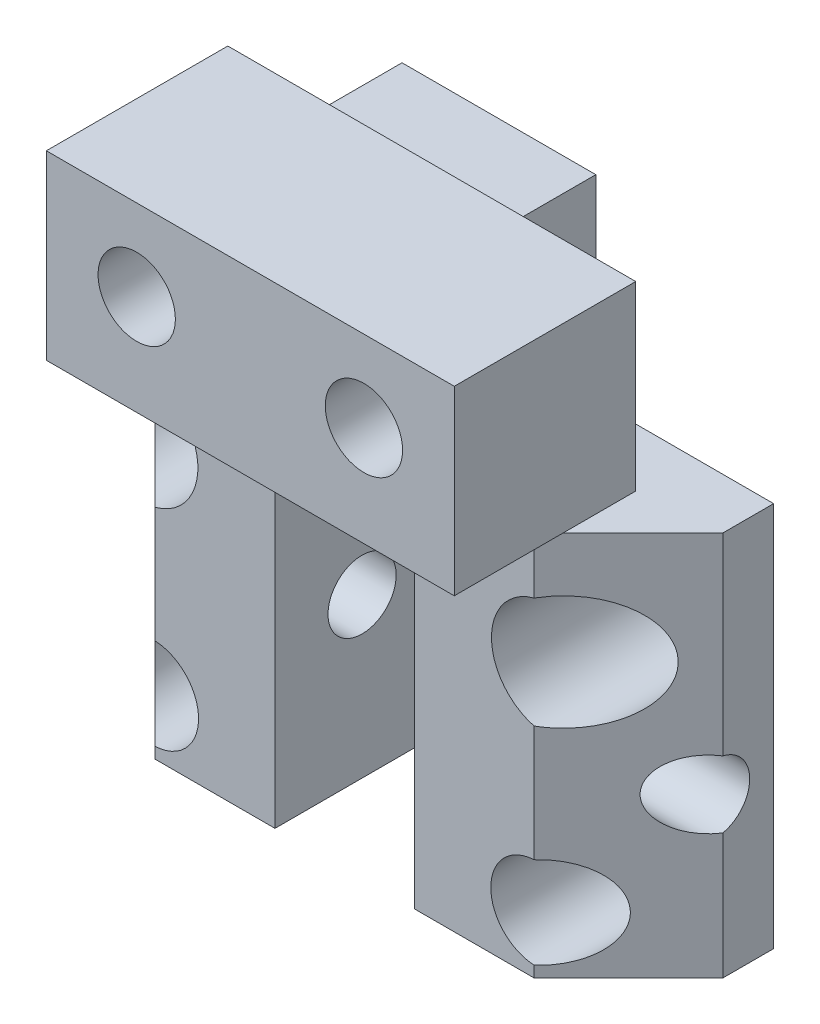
SolidWorks part; units mm, degrees
ref_plane "Front/Back" through (0, 0, 0) normal (0, 0, 1) x (1, 0, 0)
ref_plane "Top/Bottom" through (0, 0, 0) normal (0, 1, 0) x (1, 0, 0)
ref_plane "Right/Left" through (0, 0, 0) normal (1, 0, 0) x (0, 0, -1)
sketch "Sketch1" plane through (0, 0, 0) normal (0, 1, 0) x (1, 0, 0)
  line L0 (-6.7818, 6.858) -> (0, 6.858)
  line L1 (0, 6.858) -> (0, 0)
  line L2 (0, 0) -> (13.081, 0)
  line L3 (13.081, 0) -> (13.081, -5.08)
  line L4 (13.081, -5.08) -> (-6.7818, -5.08)
  line L5 (-6.7818, -5.08) -> (-6.7818, 6.858)
  line L6 (0, 0) -> (0, 54.2418) construction
  line L7 (0, 0) -> (69.3583, 0) construction
  dimension "D1" = 6.7818
  dimension "D2" = 5.08
  dimension "D3" = 11.938
  dimension "D4" = 19.8628
extrude "Extrude1" add sketch "Sketch1" along normal mid plane 13.4874
sketch "Sketch2" plane through (0, 6.7437, 0) normal (0, 1, 0) x (-1, 0, 0)
  line L0 (0, 0) -> (0, 6.5645) construction
  line L1 (0, 0) -> (7.3035, 0) construction
  line L2 (-3.1496, 5.08) -> (-3.1496, 17.5434) construction
  line L3 (-10.287, 2.032) -> (3.9878, 2.032)
  line L4 (-10.287, 2.032) -> (-10.287, 8.382)
  line L5 (-10.287, 8.382) -> (3.9878, 8.382)
  line L6 (3.9878, 2.032) -> (3.9878, 8.382)
  line L7 (6.7818, 5.08) -> (-13.081, 5.08) construction
  line L8 (-3.1496, 8.382) -> (-3.1496, 5.8947) construction
  dimension "D1" = 6.35
  dimension "D2" = 14.2748
  dimension "D3" = 3.302
extrude "Extrude2" add sketch "Sketch2" along normal blind 6.35
sketch "Sketch3" plane through (0, 0, 0) normal (0, 0, -1) x (-1, 0, 0)
  line L0 (0, 0) -> (7.6766, 0) construction
  line L1 (0, 0) -> (0, 13.9117) construction
  line L3 (-0.7112, 5.9563) -> (-5.588, 5.9563)
  line L4 (-0.7112, 5.9563) -> (-0.7112, -6.7437)
  line L5 (-0.7112, -6.7437) -> (-5.588, -6.7437)
  line L6 (-5.588, 5.9563) -> (-5.588, -6.7437)
  line L7 (-13.081, -6.7437) -> (0, -6.7437) construction
  line L10 (0, -6.7437) -> (6.7818, -6.7437) construction
  dimension "D1" = 1.4224
  dimension "D2" = 4.8768
  dimension "D3" = 12.7
extrude "Cut-Extrude1" cut sketch "Sketch3" against normal through all
chamfer "Chamfer1" distance 3.302 angle 45 1 edges at (13.081, 0, 5.08)
chamfer "Chamfer2" distance 3.302 angle 45 1 edges at (-6.7818, 0, 5.08)
sketch "Sketch6" plane through (0, 0, -6.858) normal (0, 0, -1) x (-1, 0, 0)
  line L0 (0, -6.7437) -> (6.7818, -6.7437) construction
  line L1 (-3.1496, 5.9563) -> (-3.1496, -4.5329) construction
  line L2 (-0.7112, 5.9563) -> (-5.588, 5.9563) construction
  circle A0 centre (3.9942, 2.8321) radius 2.0066
  circle A1 centre (3.5636, -4.7574) radius 1.6002
  circle A2 centre (-9.8628, -4.7574) radius 1.6002
  circle A3 centre (-10.2933, 2.8321) radius 2.0066
  dimension "D1" = 4.0132
  dimension "D3" = 3.2004
  dimension "D6" = 7.1437
  dimension "D2" = 9.5758
  dimension "D4" = 6.7132
  dimension "D5" = 7.5895
extrude "Cut-Extrude2" cut sketch "Sketch6" against normal through all
hole_wizard "#6-32 Tapped Hole1" positions "Sketch9" profile "Sketch8" tap size "#6-32" standard "ANSI Inch"
sketch "Sketch9" plane through (0, 0, 8.382) normal (0, 0, 1) x (1, 0, 0)
  line L0 (3.1496, 13.0937) -> (3.1496, 8.6262) construction
  line L1 (-3.9878, 13.0937) -> (10.287, 13.0937) construction
  arc A0 (9.779, 0.8925) -> (9.779, 4.7717) centre (10.2933, 2.8321) ccw construction
  point P0 (7.1247, 10.2489)
  point P1 (-0.8255, 10.2489)
  dimension "D2" = 7.4168
  dimension "D1" = 7.9502
sketch "Sketch8" plane through (7.1247, 10.2489, 8.382) normal (1, 0, 0) x (0, -1, 0)
  line L0 (0, 0) -> (0, 15.24)
  line L1 (0, 15.24) -> (1.3525, 15.24)
  line L2 (1.3525, 15.24) -> (1.3525, 0)
  line L5 (1.3525, 0) -> (0, 0)
  line L11 (0, -6.35) -> (0, 107.95) construction
  dimension "Thru Tap Drill Dia." = 2.7051
  dimension "Thru Tap Drill Depth" = 15.24
sketch "Sketch10" plane through (13.081, 0, 0) normal (1, 0, 0) x (0, 0, -1)
  line L0 (0, 0) -> (7.9135, 0) construction
  line L1 (0, 0) -> (0, 8.8449) construction
  line L2 (0, -6.7437) -> (6.858, -6.7437) construction
  line L3 (6.858, 6.7437) -> (6.858, -6.7437) construction
  circle A0 centre (-2.032, -1.1811) radius 1.1938
  dimension "D1" = 2.3876
  dimension "D2" = 5.5626
  dimension "D3" = 8.89
extrude "Cut-Extrude3" cut sketch "Sketch10" against normal through all
